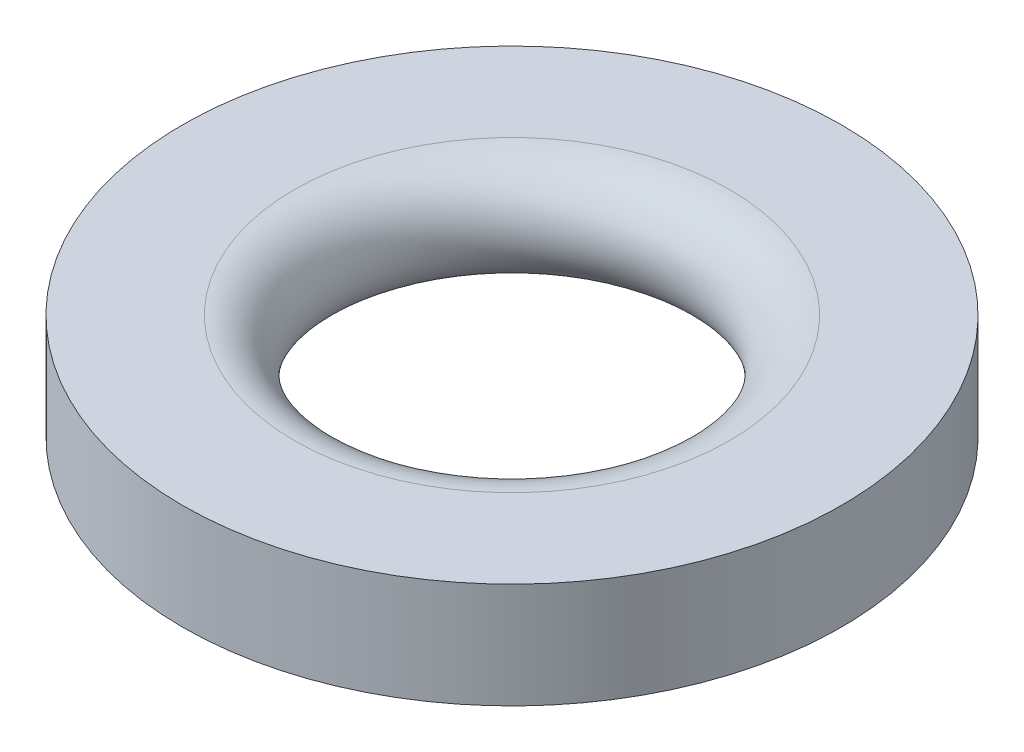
SolidWorks part; units mm, degrees
ref_plane "Front Plane" through (0, 0, 0) normal (0, 0, 1) x (1, 0, 0)
ref_plane "Top Plane" through (0, 0, 0) normal (0, 1, 0) x (1, 0, 0)
ref_plane "Right Plane" through (0, 0, 0) normal (1, 0, 0) x (0, 0, -1)
sketch "Sketch1" plane through (0, 0, 0) normal (1, 0, 0) x (0, 0, -1)
  line L0 (0, 33.2909) -> (0, -28.1692) construction
  line L1 (2.0955, 0.508) -> (3.175, 0.508)
  line L2 (3.175, 0.508) -> (3.175, -0.508)
  line L3 (3.175, -0.508) -> (2.0955, -0.508)
  arc A0 (2.0955, -0.508) -> (2.0955, 0.508) centre (2.0955, 0) cw
  point P8 (1.5875, 0)
  dimension "D1" = 1.016
  dimension "D2" = 1.5875
  dimension "D3" = 3.175
revolve "Revolve1" add sketch "Sketch1" angle 360 about L0
